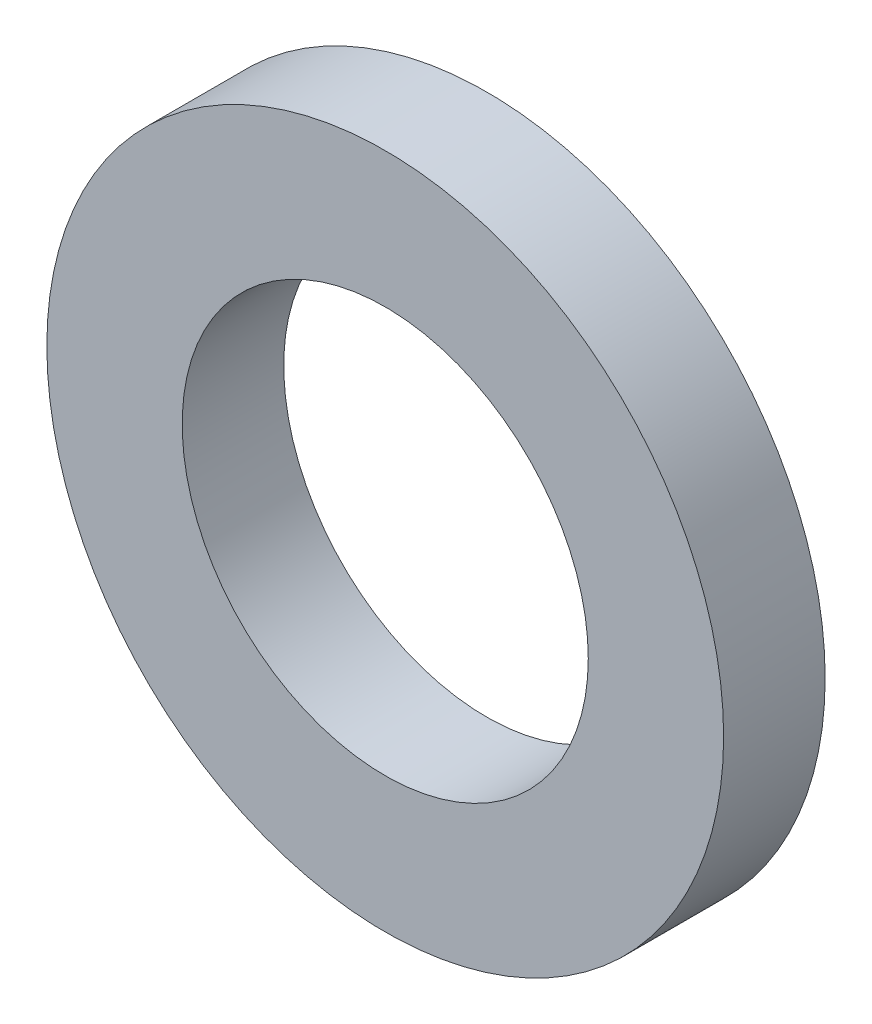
SolidWorks part; units mm, degrees
ref_plane "Plan1" through (0, 0, 0) normal (0, 0, 1) x (1, 0, 0)
ref_plane "Plan2" through (0, 0, 0) normal (0, 1, 0) x (1, 0, 0)
ref_plane "Plan3" through (0, 0, 0) normal (1, 0, 0) x (0, 0, -1)
sketch "Esquisse1" plane through (0, 0, 0) normal (0, 0, 1) x (1, 0, 0)
  circle A0 centre (0, 0) radius 10
  circle A1 centre (0, 0) radius 6
  dimension "D1" = 12
  dimension "D2" = 20
extrude "Base-Extrusion" add sketch "Esquisse1" along normal blind 3
